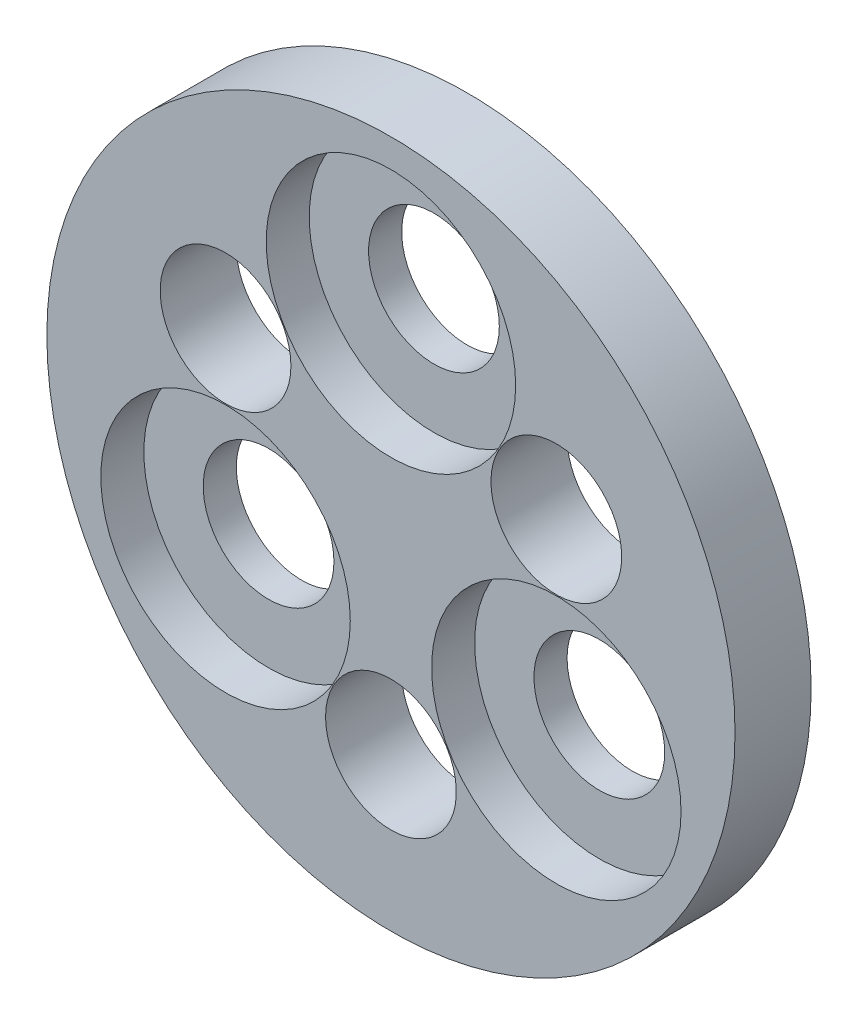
SolidWorks part; units mm, degrees
ref_plane "Front Plane" through (0, 0, 0) normal (0, 0, 1) x (1, 0, 0)
ref_plane "Top Plane" through (0, 0, 0) normal (0, 1, 0) x (1, 0, 0)
ref_plane "Right Plane" through (0, 0, 0) normal (1, 0, 0) x (0, 0, -1)
sketch "Sketch1" plane through (0, 0, 0) normal (0, 0, 1) x (1, 0, 0)
  circle A0 centre (0, 0) radius 10.16
  circle A1 centre (0, 5.6388) radius 1.9304
  circle A2 centre (0, -5.6388) radius 1.9304
  circle A3 centre (-4.8833, 2.8194) radius 1.9304
  circle A4 centre (-4.8833, -2.8194) radius 1.9304
  circle A5 centre (4.8833, -2.8194) radius 1.9304
  circle A6 centre (4.8833, 2.8194) radius 1.9304
extrude "Extrude1" add sketch "Sketch1" against normal blind 2.2479
sketch "Sketch3" plane through (0, 0, 0) normal (0, 0, 1) x (1, 0, 0)
  circle A0 centre (0, 5.6388) radius 3.683
  circle A1 centre (-4.8833, -2.8194) radius 3.683
  circle A2 centre (4.8833, -2.8194) radius 3.683
extrude "Cut-Extrude1" cut sketch "Sketch3" against normal blind 1.27
sketch "Sketch5" plane through (0, 0, 0) normal (0, 1, 0) x (1, 0, 0)
  line L0 (0, 2.2479) -> (0, 0.7423)
  line L2 (1.9304, 2.2479) -> (-1.9304, 2.2479) construction
  line L3 (0.0362, 0.7493) -> (2.1765, 2.2479)
  line L4 (0, 2.2479) -> (0, -0.2856) construction
  line L5 (0, 2.2479) -> (2.1765, 2.2479)
  arc A0 (0.0362, 0.7493) -> (0, 0.7423) centre (0.0054, 0.8114) cw
revolve "Cut-Revolve1" cut sketch "Sketch5" angle 360 about L4
